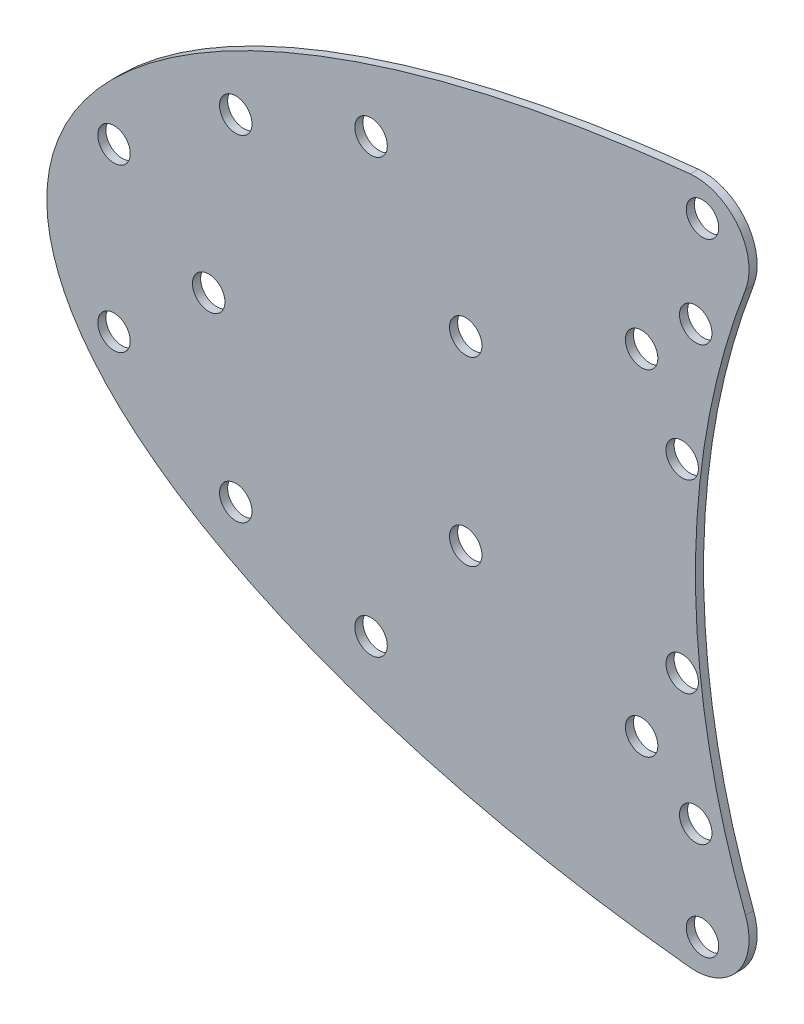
SolidWorks part; units mm, degrees
ref_plane "Plan de face" through (0, 0, 0) normal (0, 0, 1) x (1, 0, 0)
ref_plane "Plan de dessus" through (0, 0, 0) normal (0, 1, 0) x (1, 0, 0)
ref_plane "Plan de droite" through (0, 0, 0) normal (1, 0, 0) x (0, 0, -1)
ref_plane "Plan1" through (0, 0, 0) normal (0, 0, -1) x (-1, 0, 0)
sketch "Esquisse1" plane through (0, 0, 0) normal (0, 0, -1) x (-1, 0, 0)
  arc A0 (41.6076, 100.1005) -> (41.6076, -100.1005) centre (-220, 0) cw
  arc A1 (41.6076, -100.1005) -> (62.0455, -127.019) centre (60.1891, -107.2104) ccw
  arc A2 (62.0455, 127.019) -> (41.6076, 100.1005) centre (60.1891, 107.2104) ccw
  circle A3 centre (275, -30) radius 6
  circle A4 centre (275, 30) radius 6
  circle A5 centre (240, 0) radius 6
  circle A6 centre (230, 62) radius 6
  circle A7 centre (230, -62) radius 6
  circle A8 centre (180, 80) radius 6
  circle A9 centre (180, -80) radius 6
  circle A10 centre (145, -33.5) radius 6
  circle A11 centre (65, 34.2) radius 6
  circle A12 centre (145, 33.5) radius 6
  circle A13 centre (65, -34.2) radius 6
  circle A14 centre (80, 62) radius 6
  circle A15 centre (60, 80) radius 6
  circle A16 centre (60, -80) radius 6
  circle A17 centre (80, -62) radius 6
  circle A18 centre (57.5, -115) radius 6
  circle A19 centre (57.5, 115) radius 6
  ellipse E0 centre (-11.9502, 0.0004) end of major axis (-323.7363, 0.0024) minor radius 130.7547 (62.0455, -127.019) -> (62.0455, 127.019) ccw
  point P5 (-11.9502, 0.0004)
  point P6 (-323.7363, 0.0024)
  point P7 (-11.9493, 130.7551)
  point P8 (62.0455, -127.019)
  point P9 (62.0455, 127.019)
  point P10 (299.8947, -0.2517)
  point P11 (-323.7951, 0.2525)
extrude "Boss.-Extru.1" add sketch "Esquisse1" against normal blind 3
